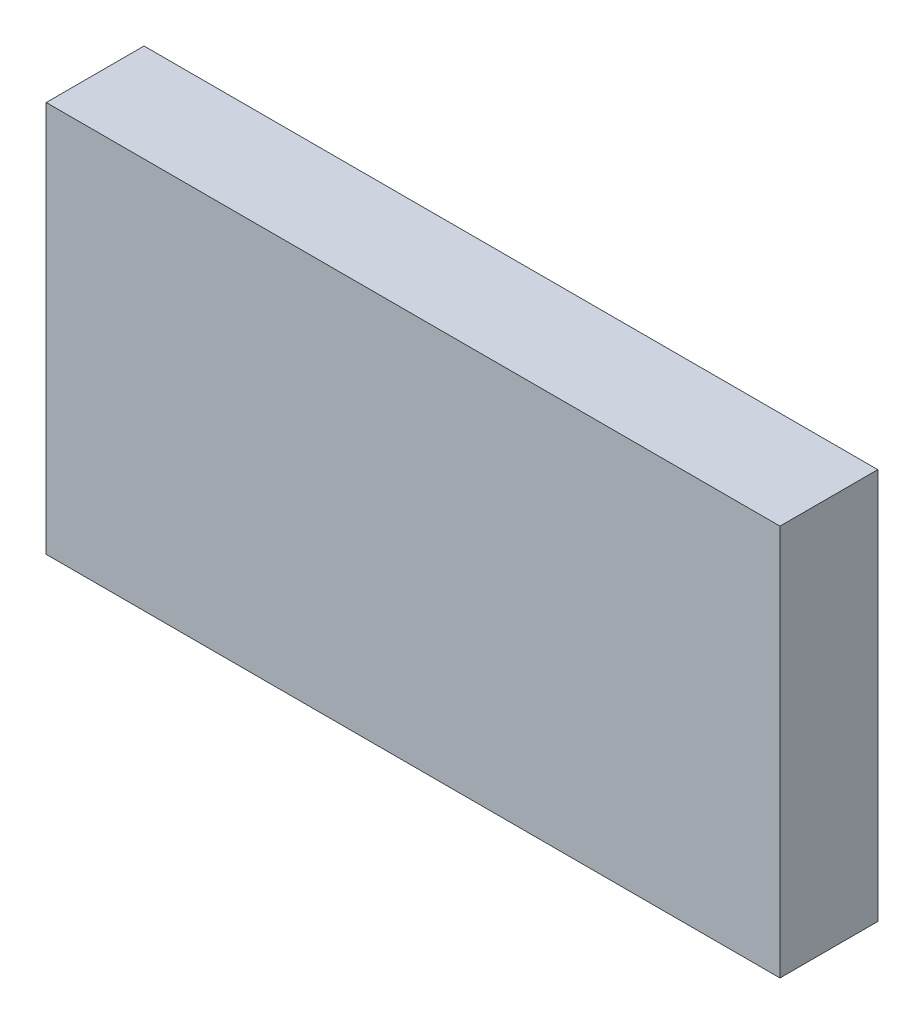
SolidWorks part; units mm, degrees
ref_plane "Vorne" through (0, 0, 0) normal (0, 0, 1) x (1, 0, 0)
ref_plane "Oben" through (0, 0, 0) normal (0, 1, 0) x (1, 0, 0)
ref_plane "Rechts" through (0, 0, 0) normal (1, 0, 0) x (0, 0, -1)
sketch "Skizze1" plane through (0, 0, 0) normal (1, 0, 0) x (0, 0, -1)
  line L1 (0, 0) -> (40, 0)
  line L2 (0, 0) -> (0, 160)
  line L3 (0, 160) -> (40, 160)
  line L4 (40, 0) -> (40, 160)
  dimension "D1" = 160
  dimension "D2" = 40
extrude "Aufsatz-Linear austragen1" add sketch "Skizze1" along normal mid plane 300
